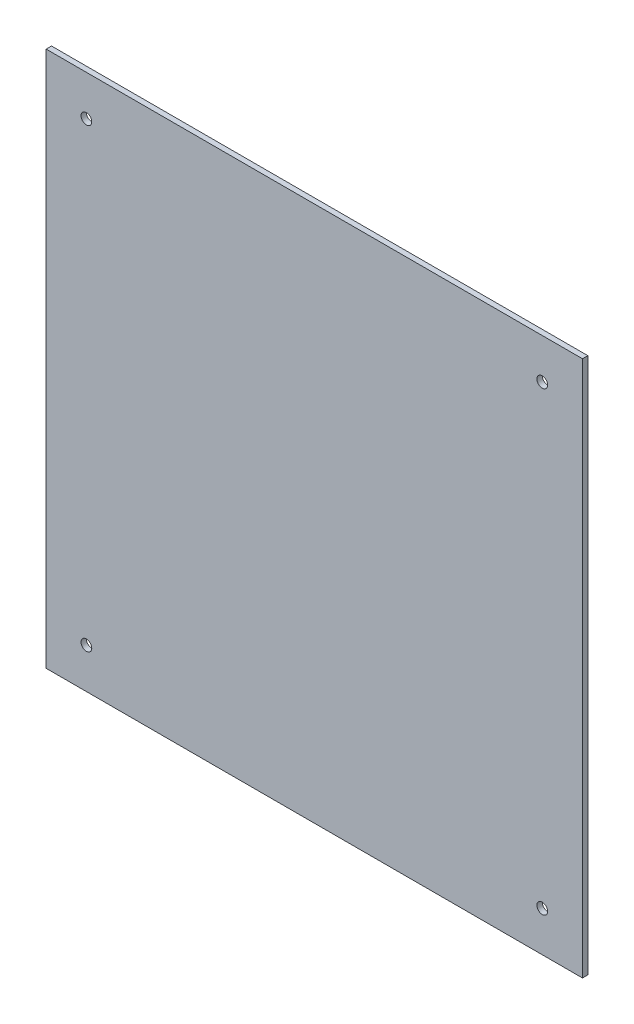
SolidWorks part; units mm, degrees
ref_plane "Plan de face" through (0, 0, 0) normal (0, 0, 1) x (1, 0, 0)
ref_plane "Plan de dessus" through (0, 0, 0) normal (0, 1, 0) x (1, 0, 0)
ref_plane "Plan de droite" through (0, 0, 0) normal (1, 0, 0) x (0, 0, -1)
sketch "Esquisse1" plane through (0, 0, 0) normal (0, 0, 1) x (1, 0, 0)
  line L0 (0, 0) -> (200, 0)
  line L1 (200, 0) -> (200, -200)
  line L2 (200, -200) -> (0, -200)
  line L3 (0, -200) -> (0, 0)
  circle A0 centre (15, -15) radius 2
  circle A1 centre (185, -15) radius 2
  circle A2 centre (185, -185) radius 2
  circle A3 centre (15, -185) radius 2
  dimension "D3" = 15
  dimension "D4" = 4
  dimension "D5" = 15
  dimension "D6" = 15
  dimension "D7" = 15
  dimension "D9" = 15
  dimension "D10" = 15
  dimension "D11" = 15
  dimension "D1" = 200
  dimension "D2" = 200
  dimension "D8" = 15
extrude "Extrusion1" add sketch "Esquisse1" along normal blind 2
sketch "Esquisse2" plane through (0, 0, 2) normal (0, 0, 1) x (1, 0, 0)
  line L0 (100, 0) -> (100, -200) construction
  line L1 (200, 0) -> (0, 0) construction
  line L2 (0, -200) -> (200, -200) construction
  circle A0 centre (100, -100) radius 23.1407
